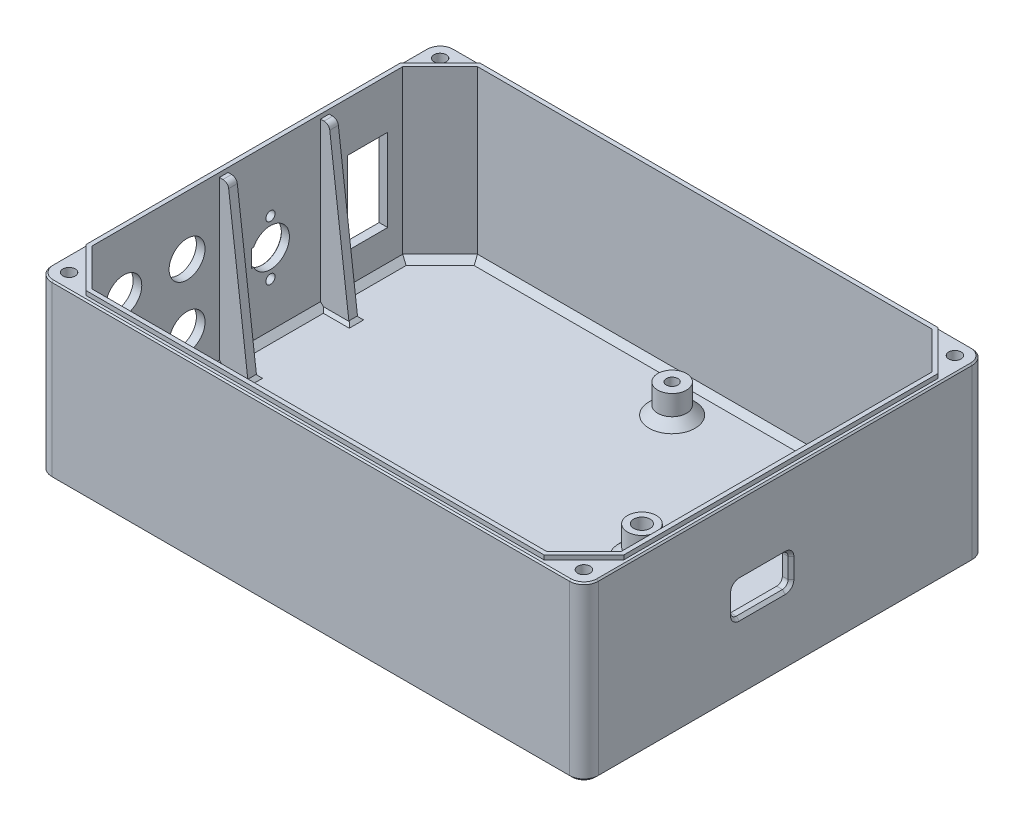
SolidWorks part; units mm, degrees
ref_plane "Front Plane" through (0, 0, 0) normal (0, 0, 1) x (1, 0, 0)
ref_plane "Top Plane" through (0, 0, 0) normal (0, 1, 0) x (1, 0, 0)
ref_plane "Right Plane" through (0, 0, 0) normal (1, 0, 0) x (0, 0, -1)
sketch "Sketch2" plane through (0, 0, 0) normal (0, 1, 0) x (1, 0, 0)
  line L1 (-95, 70) -> (95, 70)
  line L2 (-95, 70) -> (-95, -70)
  line L3 (-95, -70) -> (95, -70)
  line L4 (95, 70) -> (95, -70)
  line L5 (-95, 70) -> (95, -70) construction
  line L6 (-95, -70) -> (95, 70) construction
  point P0 (0, 0)
  dimension "D1" = 190
  dimension "D2" = 140
extrude "Enclosure body" add sketch "Sketch2" along normal blind 60
fillet "Fillet1" radius 5 4 edges at (-95, 30, 70) (-95, 30, -70) (95, 30, -70) (95, 30, 70)
shell "Shell1" thickness 3
sketch "Sketch3" plane through (0, 3, 0) normal (0, 1, 0) x (1, 0, 0)
  line L1 (1.2704, 54.4166) -> (76.2704, 54.4166) construction
  line L2 (1.2704, 54.4166) -> (1.2704, -55.5834) construction
  line L3 (1.2704, -55.5834) -> (76.2704, -55.5834) construction
  line L4 (76.2704, 54.4166) -> (76.2704, -55.5834) construction
  line L5 (1.2704, 54.4166) -> (76.2704, -55.5834) construction
  line L6 (1.2704, -55.5834) -> (76.2704, 54.4166) construction
  circle A0 centre (1.2704, 54.4166) radius 5
  circle A1 centre (1.2704, 54.4166) radius 2
  circle A2 centre (76.2704, 54.4166) radius 5
  circle A3 centre (76.2704, 54.4166) radius 2
  circle A4 centre (76.2704, -55.5834) radius 5
  circle A5 centre (76.2704, -55.5834) radius 2
  circle A6 centre (1.2704, -55.5834) radius 5
  circle A7 centre (1.2704, -55.5834) radius 2
  circle A9 centre (38.7704, 6.4166) radius 2.85
  circle A10 centre (38.7704, 6.4166) radius 5
  dimension "D3" = 4
  dimension "D4" = 10
  dimension "D1" = 10
  dimension "D2" = 5.7
  dimension "D5" = 2
  dimension "D6" = 2
extrude "PCB Supports" add sketch "Sketch3" along normal blind 10
sketch "Sketch6" plane through (0, 3, 0) normal (0, 1, 0) x (1, 0, 0)
  line L0 (-79, 67) -> (-92, 54)
  line L1 (-92, -54) -> (-79, -67)
  line L2 (79, -67) -> (92, -54)
  line L3 (79, 67) -> (92, 54)
  line L4 (-90, -67) -> (90, -67)
  line L5 (92, -65) -> (92, 65)
  line L6 (90, 67) -> (-90, 67)
  line L7 (-90, -67) -> (-79, -67)
  line L9 (92, -65) -> (92, -54)
  line L10 (90, 67) -> (79, 67)
  line L12 (-79, 67) -> (-90, 67)
  line L15 (92, 54) -> (92, 65)
  line L16 (-92, 65) -> (-92, -65) construction
  line L17 (-90, -67) -> (90, -67) construction
  line L18 (92, -65) -> (92, 65) construction
  line L19 (-92, -54) -> (-92, -65)
  line L20 (79, -67) -> (90, -67)
  line L21 (-92, 65) -> (-92, -65)
  line L22 (-92, 65) -> (-92, 54)
  line L26 (90, 67) -> (-90, 67) construction
  arc A4 (90, -67) -> (92, -65) centre (90, -65) ccw
  arc A5 (92, 65) -> (90, 67) centre (90, 65) ccw
  arc A6 (-90, 67) -> (-92, 65) centre (-90, 65) ccw
  arc A7 (-90, 67) -> (-92, 65) centre (-90, 65) ccw
  arc A8 (90, -67) -> (92, -65) centre (90, -65) ccw
  arc A9 (92, 65) -> (90, 67) centre (90, 65) ccw
  arc A12 (-92, -65) -> (-90, -67) centre (-90, -65) ccw
  arc A13 (-92, -65) -> (-90, -67) centre (-90, -65) ccw
  dimension "D3" = 13
  dimension "D4" = 13
  dimension "D5" = 13
  dimension "D6" = 13
  dimension "D7" = 13
  dimension "D8" = 13
  dimension "D9" = 13
  dimension "D1" = 0
extrude "Enclosure corner flanges" add sketch "Sketch6" along normal up to vertex (57 mm away)
sketch "Sketch8" plane through (0, 0, 0) normal (0, -1, 0) x (1, 0, 0)
  line L0 (-85.5, 60.5) -> (-93.5355, 68.5355) construction
  line L1 (-92, -54) -> (-79, -67) construction
  line L2 (85.5, 60.5) -> (93.5355, 68.5355) construction
  line L3 (79, -67) -> (92, -54) construction
  line L4 (-93.5355, -68.5355) -> (-85.5, -60.5) construction
  line L5 (92, 54) -> (79, 67) construction
  line L6 (93.5355, -68.5355) -> (85.5, -60.5) construction
  line L7 (-79, 67) -> (-92, 54) construction
  arc A0 (-90, 70) -> (-95, 65) centre (-90, 65) ccw construction
  arc A1 (95, 65) -> (90, 70) centre (90, 65) ccw construction
  arc A2 (-95, -65) -> (-90, -70) centre (-90, -65) ccw construction
  arc A3 (90, -70) -> (95, -65) centre (90, -65) ccw construction
  circle A4 centre (89.5178, -64.5178) radius 3.8
  circle A5 centre (89.5178, 64.5178) radius 3.8
  circle A6 centre (-89.5178, 64.5178) radius 3.8
  circle A7 centre (-89.5178, -64.5178) radius 3.8
  dimension "D1" = 7.6
  dimension "D2" = 7.6
  dimension "D3" = 7.6
  dimension "D4" = 7.6
extrude "Cut-Extrude1" cut sketch "Sketch8" against normal offset from surface (45.5 mm away) 14.5
sketch "Sketch9" plane through (0, 45.5, 0) normal (0, -1, 0) x (1, 0, 0)
  circle A0 centre (-89.5178, 64.5178) radius 2.15
  circle A1 centre (89.5178, 64.5178) radius 2.15
  circle A2 centre (89.5178, -64.5178) radius 2.15
  circle A3 centre (-89.5178, -64.5178) radius 2.15
  circle A4 centre (-89.5178, 64.5178) radius 3.8 construction
  circle A5 centre (-89.5178, -64.5178) radius 3.8 construction
  circle A6 centre (89.5178, -64.5178) radius 3.8 construction
  circle A7 centre (89.5178, 64.5178) radius 3.8 construction
  dimension "D1" = 4.3
  dimension "D2" = 4.3
  dimension "D3" = 4.3
  dimension "D4" = 4.3
extrude "Cut-Extrude2" cut sketch "Sketch9" against normal through all
chamfer "Chamfer1" distance 2 angle 45 8 edges at (-85.5, 3, 60.5) (-92, 3, 0) (-85.5, 3, -60.5) (0, 3, -67) (85.5, 3, -60.5) (0, 3, 67) (85.5, 3, 60.5) (92, 3, 0)
sketch "Sketch10" plane through (95, 0, -30) normal (-1, 0, 0) x (0, 0, 1)
  line L1 (29.9831, 35) -> (45.9831, 35)
  line L2 (27.9831, 33) -> (27.9831, 26)
  line L3 (29.9831, 24) -> (45.9831, 24)
  line L4 (47.9831, 33) -> (47.9831, 26)
  line L5 (27.9831, 35) -> (47.9831, 24) construction
  line L6 (27.9831, 24) -> (47.9831, 35) construction
  line L7 (-35, 0) -> (95, 0) construction
  arc A0 (45.9831, 35) -> (47.9831, 33) centre (45.9831, 33) cw
  arc A1 (45.9831, 24) -> (47.9831, 26) centre (45.9831, 26) ccw
  arc A2 (27.9831, 26) -> (29.9831, 24) centre (29.9831, 26) ccw
  arc A3 (29.9831, 35) -> (27.9831, 33) centre (29.9831, 33) ccw
  point P0 (37.9831, 29.5)
  dimension "D1" = 2
  dimension "D2" = 29.5
  dimension "D3" = 11
  dimension "D4" = 20
extrude "USB cutout" cut sketch "Sketch10" along normal blind 6
sketch "Sketch11" plane through (-95, 0, 0) normal (-1, 0, 0) x (0, 0, 1)
  line L0 (-64.7737, 30) -> (65, 30) construction
  line L1 (-2.1212, 33) -> (-1.4, 33)
  line L2 (-48.7737, 44.35) -> (-34.7737, 44.35)
  line L3 (-8, 20.5) -> (-8, 39.5) construction
  line L8 (-48.7737, 44.35) -> (-48.7737, 15.65)
  line L9 (21, 41) -> (43, 41) construction
  line L10 (-1.4, 33) -> (-1.4, 27)
  line L11 (21, 41) -> (21, 19) construction
  line L12 (21, 19) -> (43, 19) construction
  line L13 (43, 41) -> (43, 19) construction
  line L14 (21, 41) -> (43, 19) construction
  line L15 (21, 19) -> (43, 41) construction
  line L16 (-65, 0) -> (65, 0) construction
  line L17 (-48.7737, 15.65) -> (-34.7737, 15.65)
  line L18 (-34.7737, 44.35) -> (-34.7737, 15.65)
  line L19 (-48.7737, 44.35) -> (-34.7737, 15.65) construction
  line L20 (-48.7737, 15.65) -> (-34.7737, 44.35) construction
  line L21 (-2.1212, 27) -> (-1.4, 27)
  line L22 (-65, 60) -> (-65, 0) construction
  arc A1 (-2.1212, 33) -> (-2.1212, 27) centre (-8, 30) ccw
  circle A7 centre (-8, 39.5) radius 1.6
  circle A8 centre (-8, 20.5) radius 1.6
  circle A10 centre (21, 41) radius 6.25
  circle A11 centre (21, 19) radius 6.25
  circle A12 centre (43, 19) radius 6.25
  circle A13 centre (43, 41) radius 6.25
  circle A14 centre (43, 41) radius 7.5 construction
  point P2 (-41.7737, 30)
  point P10 (32, 30)
  dimension "D4" = 28.7
  dimension "D5" = 13.2
  dimension "D8" = 3.2
  dimension "D9" = 3.2
  dimension "D12" = 12.5
  dimension "D13" = 12.5
  dimension "D14" = 3
  dimension "D15" = 12.5
  dimension "D16" = 12.5
  dimension "D18" = 15
  dimension "D19" = 3
  dimension "D2" = 22
  dimension "D3" = 22
  dimension "D6" = 19
  dimension "D7" = 30
  dimension "D10" = 14
  dimension "D11" = 9.5
  dimension "D17" = 40
  dimension "D20" = 23
  dimension "D21" = 57
extrude "Button cutouts" cut sketch "Sketch11" against normal blind 6
chamfer "Chamfer3" distance 1 angle 45 8 edges at (0, 0, -70) (-93.5355, 0, -68.5355) (93.5355, 0, -68.5355) (-95, 0, 0) (95, 0, 0) (-93.5355, 0, 68.5355) (93.5355, 0, 68.5355) (0, 0, 70)
sketch "Sketch14" plane through (0, 60, 0) normal (0, 1, 0) x (1, 0, 0)
ref_plane "Plane1" through (0, 0, 0) normal (0, -1, 0) x (-1, 0, 0)
sketch "Sketch15" plane through (-92, 0, 0) normal (1, 0, 0) x (0, 0, -1)
  line L0 (53.1716, 3) -> (-53.1716, 3) construction
  line L1 (-34.0694, 3) -> (-31.0694, 3)
  line L2 (-34.0694, 3) -> (-34.0694, 15.6591)
  line L3 (-34.0694, 15.6591) -> (-31.0694, 15.6591)
  line L4 (-31.0694, 3) -> (-31.0694, 15.6591)
  line L5 (54, 60) -> (-54, 60) construction
  line L6 (25.408, 3) -> (28.408, 3)
  line L7 (25.408, 3) -> (25.408, 60)
  line L8 (25.408, 60) -> (28.408, 60)
  line L9 (28.408, 3) -> (28.408, 60)
  line L10 (-65, 0) -> (65, 0) construction
  line L11 (-53.1716, 3) -> (53.1716, 3) construction
  line L12 (-9.7469, 60) -> (-6.7469, 60)
  line L13 (-9.7469, 60) -> (-9.7469, 3)
  line L14 (-9.7469, 3) -> (-6.7469, 3)
  line L15 (-6.7469, 60) -> (-6.7469, 3)
  dimension "D1" = 15.6591
  dimension "D2" = 3
  dimension "D3" = 3
  dimension "D4" = 3
extrude "Boss-Extrude6" add sketch "Sketch15" along normal blind 10
sketch "Sketch16" plane through (0, 0, 34.0694) normal (0, 0, 1) x (1, 0, 0)
  line L0 (-82, 60) -> (-82, 3)
  line L1 (-82, 3) -> (-89, 60)
  line L2 (-82, 60) -> (-92, 60) construction
  line L3 (-89, 60) -> (-82, 60)
  dimension "D1" = 7
extrude "Cut-Extrude3" cut sketch "Sketch16" against normal up to surface (62.4775 mm away)
chamfer "Chamfer4" distance 3 angle 45 5 edges at (76.2704, 3, 60.5834) (1.2704, 3, 60.5834) (76.2704, 3, -49.4166) (38.7704, 3, -1.4166) (1.2704, 3, -49.4166)
fillet "Fillet2" radius 2 3 edges at (-83.5546, 15.6591, 32.5694) (-89, 60, -26.908) (-89, 60, 8.2469)
sketch "Sketch17" plane through (0, 60, 0) normal (0, 1, 0) x (1, 0, 0)
  line L0 (79, 67) -> (92, 54) construction
  line L1 (92, -54) -> (92, 54) construction
  line L2 (92, -54) -> (79, -67) construction
  line L3 (79, -67) -> (-79, -67) construction
  line L4 (-79, -67) -> (-92, -54) construction
  line L5 (79, 67) -> (-79, 67) construction
  line L6 (-92, 54) -> (-79, 67) construction
  line L7 (79, 67) -> (92, 54)
  line L8 (92, -54) -> (92, 54)
  line L9 (92, -54) -> (79, -67)
  line L10 (79, -67) -> (-79, -67)
  line L11 (-79, -67) -> (-92, -54)
  line L12 (79, 67) -> (-79, 67)
  line L13 (-92, 54) -> (-79, 67)
  line L14 (-92, 54) -> (-92, -54)
  line L15 (-93.5, 54.6213) -> (-93.5, -54.6213)
  line L16 (-79.6213, -68.5) -> (-93.5, -54.6213)
  line L17 (79.6213, -68.5) -> (-79.6213, -68.5)
  line L18 (93.5, -54.6213) -> (79.6213, -68.5)
  line L19 (93.5, -54.6213) -> (93.5, 54.6213)
  line L20 (79.6213, 68.5) -> (93.5, 54.6213)
  line L21 (79.6213, 68.5) -> (-79.6213, 68.5)
  line L22 (-93.5, 54.6213) -> (-79.6213, 68.5)
  dimension "D1" = 1.5
extrude "Boss-Extrude7" add sketch "Sketch17" along normal blind 1.5
chamfer "Chamfer5" distance 1 angle 45 9 edges at (-86, 3, -28.408) (-82, 3, -26.908) (-86, 3, -25.408) (-86, 3, 9.7469) (-86, 3, 6.7469) (-82, 3, 8.2469) (-86, 3, 31.0694) (-82, 3, 32.5694) (-86, 3, 34.0694)
chamfer "Chamfer6" distance 1 angle 45 8 edges at (95, 29.5, 17.9831) (95, 34.4142, 17.3973) (95, 24.5858, 17.3973) (95, 35, 7.9831) (95, 24, 7.9831) (95, 34.4142, -1.4311) (95, 24.5858, -1.4311) (95, 29.5, -2.0169)
chamfer "Chamfer7" distance 0.2 angle 45 1 edges at (-95, 30, -14.6)
chamfer "Chamfer8" distance 0.5 angle 45 8 edges at (0, 60, -70) (-93.5355, 60, -68.5355) (93.5355, 60, -68.5355) (-95, 60, 0) (95, 60, 0) (-93.5355, 60, 68.5355) (93.5355, 60, 68.5355) (0, 60, 70)
